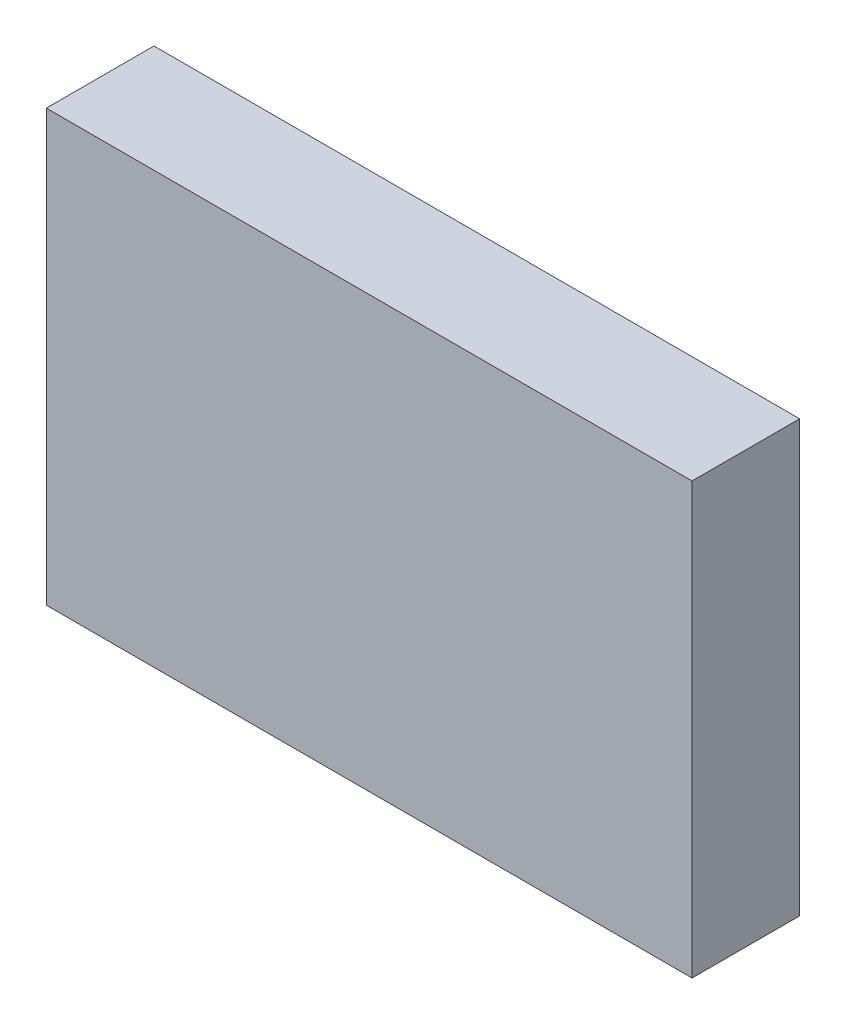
SolidWorks part; units mm, degrees
ref_plane "前视基准面" through (0, 0, 0) normal (0, 0, 1) x (1, 0, 0)
ref_plane "上视基准面" through (0, 0, 0) normal (0, 1, 0) x (1, 0, 0)
ref_plane "右视基准面" through (0, 0, 0) normal (1, 0, 0) x (0, 0, -1)
other "Configuration Table"
sketch "草图1" plane through (0, 0, 0) normal (0, 0, 1) x (1, 0, 0)
  line L1 (-150, -100) -> (150, -100)
  line L2 (-150, -100) -> (-150, 100)
  line L3 (-150, 100) -> (150, 100)
  line L4 (150, -100) -> (150, 100)
  line L5 (-150, -100) -> (150, 100) construction
  line L6 (-150, 100) -> (150, -100) construction
extrude "凸台-拉伸1" add sketch "草图1" against normal blind 50
